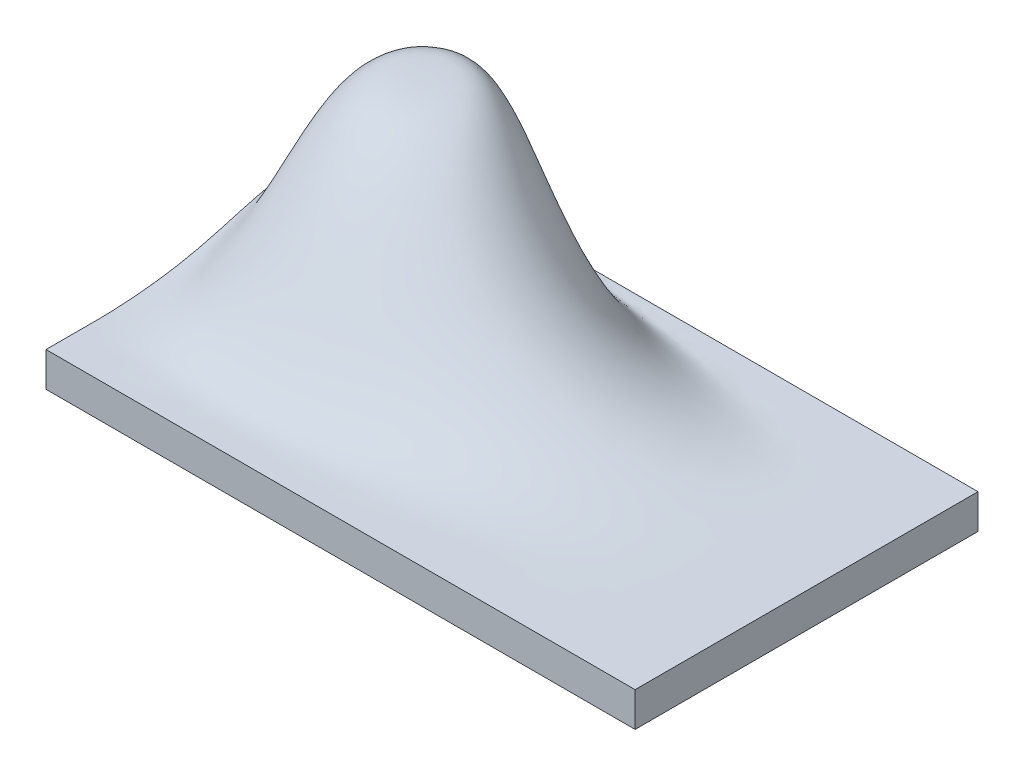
SolidWorks part; units mm, degrees
ref_plane "Front" through (0, 0, 0) normal (0, 0, 1) x (1, 0, 0)
ref_plane "Top" through (0, 0, 0) normal (0, 1, 0) x (1, 0, 0)
ref_plane "Right" through (0, 0, 0) normal (1, 0, 0) x (0, 0, -1)
sketch "Sketch1" plane through (0, 0, 0) normal (0, 1, 0) x (1, 0, 0)
  line L1 (-83.5956, 51.8031) -> (87.3359, 51.8031)
  line L2 (-83.5956, 51.8031) -> (-83.5956, -47.6888)
  line L3 (-83.5956, -47.6888) -> (87.3359, -47.6888)
  line L4 (87.3359, 51.8031) -> (87.3359, -47.6888)
extrude "Extrude1" add sketch "Sketch1" along normal blind 10
other "Deform" parameters "D1"=50, "D2"=100
